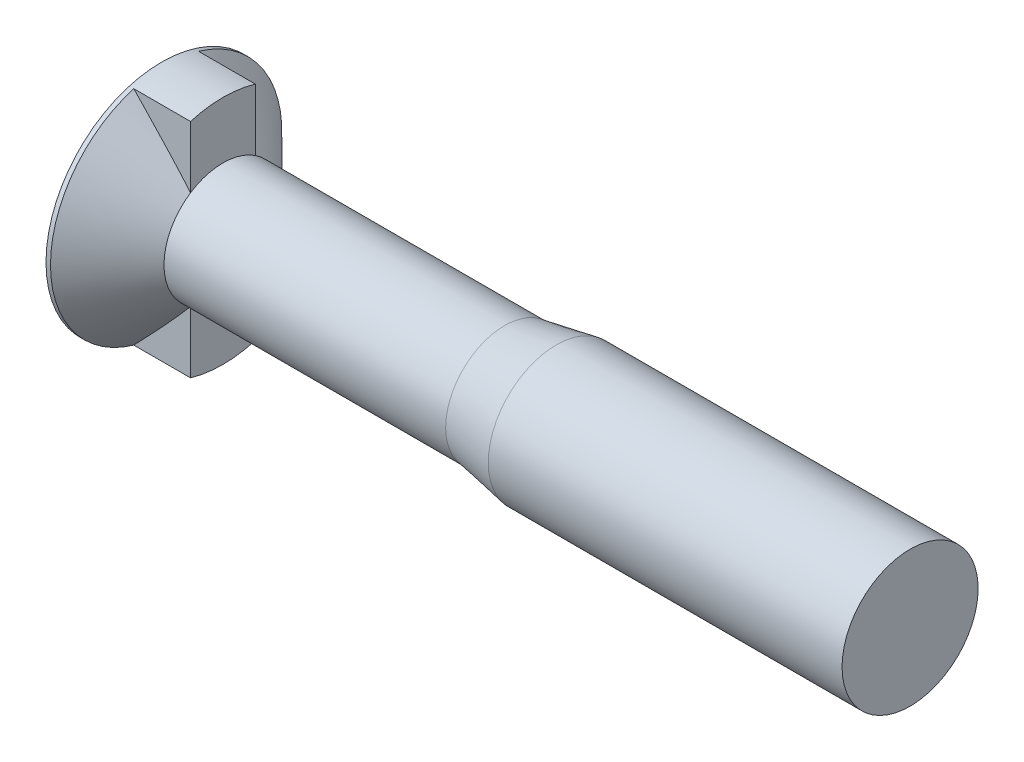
SolidWorks part; units mm, degrees
ref_plane "Front" through (0, 0, 0) normal (0, 0, 1) x (1, 0, 0)
ref_plane "Top" through (0, 0, 0) normal (0, 1, 0) x (1, 0, 0)
ref_plane "Right" through (0, 0, 0) normal (1, 0, 0) x (0, 0, -1)
sketch "Sketch2" plane through (0, 0, 0) normal (0, 0, 1) x (1, 0, 0)
  line L0 (-4.9405, 0) -> (36.2951, 0) construction
  line L1 (0, 0) -> (0, 8.5)
  line L2 (0, 8.5) -> (0.33, 8.5)
  line L3 (0.33, 8.5) -> (4.5, 4.33)
  line L4 (4.5, 4.33) -> (25.2, 4.33)
  line L5 (55, 5) -> (55, 0)
  line L6 (55, 0) -> (0, 0)
  line L7 (25.2, 4.33) -> (29, 5)
  line L8 (29, 5) -> (55, 5)
  dimension "D1" = 45
  dimension "D2" = 10
  dimension "d" = 10
  dimension "l" = 55
  dimension "k" = 4.5
  dimension "dk" = 17
  dimension "b" = 26
  dimension "X" = 3.8
revolve "Base" add sketch "Sketch2" angle 360 about L0
sketch "Sketch3" plane through (0, 0, 0) normal (0, 0, 1) x (1, 0, 0)
  line L0 (-0.9415, 0) -> (6.8139, 0) construction
  line L2 (0, 8.5) -> (4.5, 8.5)
  line L4 (4.5, 8.5) -> (4.5, -8.5)
  line L5 (4.5, -8.5) -> (0, -8.5)
  line L6 (0, -8.5) -> (0, 8.5)
  line L8 (0, 8.5) -> (0, -8.5) construction
  dimension "D1" = 17
  dimension "D2" = 4.5
extrude "Nib" add sketch "Sketch3" along normal mid plane 4.76
sketch "Sketch4" plane through (0, 0, 0) normal (-1, 0, 0) x (0, 0, 1)
  circle A0 centre (0, 0) radius 8.5 construction
  circle A1 centre (0, 0) radius 8.5
extrude "Cut-Extrude1" cut sketch "Sketch4" against normal through all flip side to cut
sketch "Sketch5" plane through (0, 0, 0) normal (0, 0, 1) x (1, 0, 0)
  line L0 (54.3878, 6.2244) -> (55.6122, 6.2244)
  line L1 (55.6122, 6.2244) -> (55.6122, 5)
  line L2 (55.6122, 5) -> (55, 3.9396)
  line L3 (54.3878, 5) -> (55, 3.9396)
  line L4 (54.3878, 6.2244) -> (54.3878, 5)
  line L5 (55, 0) -> (0, 0) construction
  line L6 (54.3878, 5) -> (55.6122, 5) construction
  line L7 (55, 5) -> (55, 3.9396) construction
  line L9 (55, 5) -> (29, 5) construction
  line L10 (55, -5) -> (55, 5) construction
  point P5 (55, 6.2244)
  dimension "D2" = 1.2244
revolve "Cut-Revolve10" [suppressed] cut sketch "Sketch5" angle 360 about L5
pattern_linear "LPattern10" [suppressed] count 18 spacing 1.4693 along (1, 0, 0)
equation "\"D1@Sketch3\" = \"dk@Sketch2\""
equation "\"D2@Sketch3\" = \"k@Sketch2\""
equation "\"D2@Sketch5\" =  ( \"d@Sketch2\" - \"D2@ThreadCosmetic1\" )  / 2"
equation "\"D3@LPattern10\" = \"D2@Sketch5\" * 1.2"
equation "\"D1@LPattern10\" = \"b@Sketch2\" / \"D3@LPattern10\""
